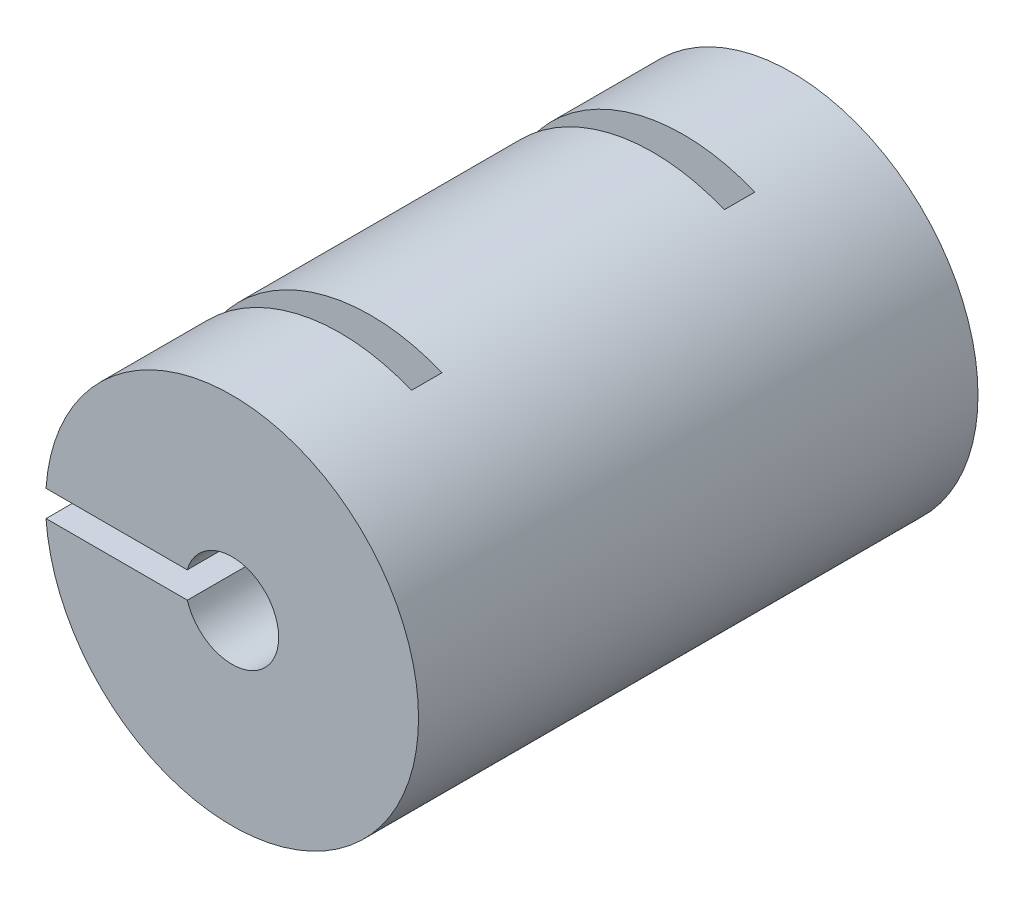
SolidWorks part; units mm, degrees
ref_plane "Front" through (0, 0, 0) normal (0, 0, 1) x (1, 0, 0)
ref_plane "Top" through (0, 0, 0) normal (0, 1, 0) x (1, 0, 0)
ref_plane "Right" through (0, 0, 0) normal (1, 0, 0) x (0, 0, -1)
sketch "Sketch1" plane through (0, 0, 0) normal (0, 0, 1) x (1, 0, 0)
  circle A0 centre (0, 0) radius 1.5875
  circle A1 centre (0, 0) radius 6.35
  dimension "D1" = 3.175
  dimension "D2" = 12.7
extrude "Extrude1" add sketch "Sketch1" along normal mid plane 19.05
sketch "Sketch2" plane through (0, 0, 9.525) normal (0, 0, 1) x (1, 0, 0)
  line L1 (0.2637, 0.4364) -> (-8.3012, 0.4364)
  line L2 (0.2637, 0.4364) -> (0.2637, -0.4546)
  line L3 (0.2637, -0.4546) -> (-8.3012, -0.4546)
  line L4 (-8.3012, 0.4364) -> (-8.3012, -0.4546)
extrude "Cut-Extrude1" cut sketch "Sketch2" against normal blind 5.08
sketch "Sketch3" plane through (0, 0, 0) normal (0, 1, 0) x (1, 0, 0)
  line L1 (-11.075, -4.8069) -> (2.429, -4.8069)
  line L2 (-11.075, -4.8069) -> (-11.075, -5.8456)
  line L3 (-11.075, -5.8456) -> (2.429, -5.8456)
  line L4 (2.429, -4.8069) -> (2.429, -5.8456)
extrude "Cut-Extrude2" cut sketch "Sketch3" against normal through all and the other way through all
mirror "Mirror1" about plane through (0, 0, 0) normal (0, 0, 1) of "Cut-Extrude2", "Cut-Extrude1"
